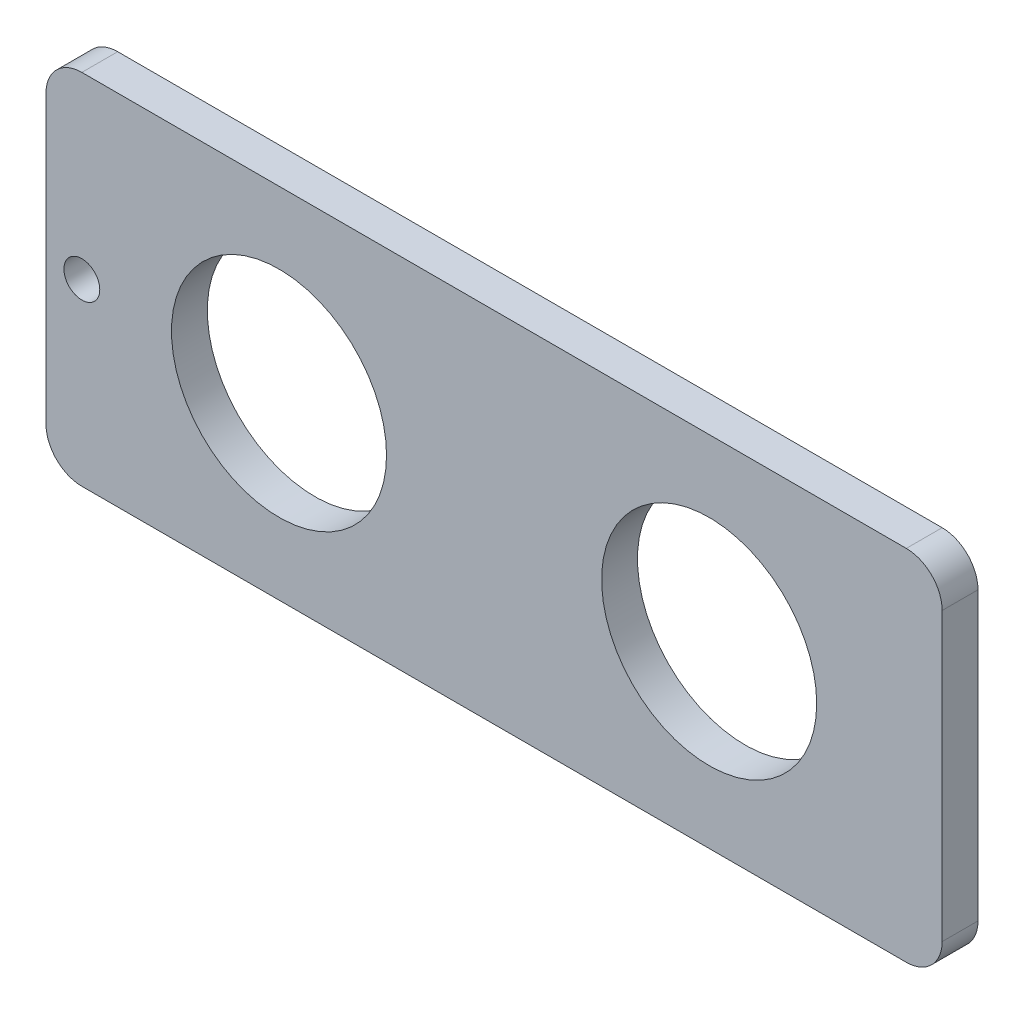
SolidWorks part; units mm, degrees
ref_plane "Plan de face" through (0, 0, 0) normal (0, 0, 1) x (1, 0, 0)
ref_plane "Plan de dessus" through (0, 0, 0) normal (0, 1, 0) x (1, 0, 0)
ref_plane "Plan de droite" through (0, 0, 0) normal (1, 0, 0) x (0, 0, -1)
sketch "Esquisse1" plane through (0, 0, 0) normal (0, 0, 1) x (1, 0, 0)
  line L1 (-11.5, -5) -> (11.5, -5)
  line L2 (-12.5, -4) -> (-12.5, 4)
  line L3 (-11.5, 5) -> (11.5, 5)
  line L4 (12.5, -4) -> (12.5, 4)
  line L5 (-12.5, -5) -> (12.5, 5) construction
  line L6 (-12.5, 5) -> (12.5, -5) construction
  arc A0 (11.5, 5) -> (12.5, 4) centre (11.5, 4) cw
  arc A1 (11.5, -5) -> (12.5, -4) centre (11.5, -4) ccw
  arc A2 (-11.5, -5) -> (-12.5, -4) centre (-11.5, -4) cw
  arc A3 (-12.5, 4) -> (-11.5, 5) centre (-11.5, 4) cw
  circle A4 centre (-6, 0) radius 3
  circle A5 centre (6, 0) radius 3
  circle A6 centre (-11.5, 0) radius 0.5
  point P0 (0, 0)
  dimension "D3" = 1
  dimension "D4" = 6
  dimension "D5" = 6
  dimension "D6" = 6
  dimension "D7" = 6
  dimension "D8" = 11.5
  dimension "D1" = 25
  dimension "D2" = 10
extrude "Boss.-Extru.1" add sketch "Esquisse1" along normal blind 1
ref_point "Point1"
ref_point "Point2"
